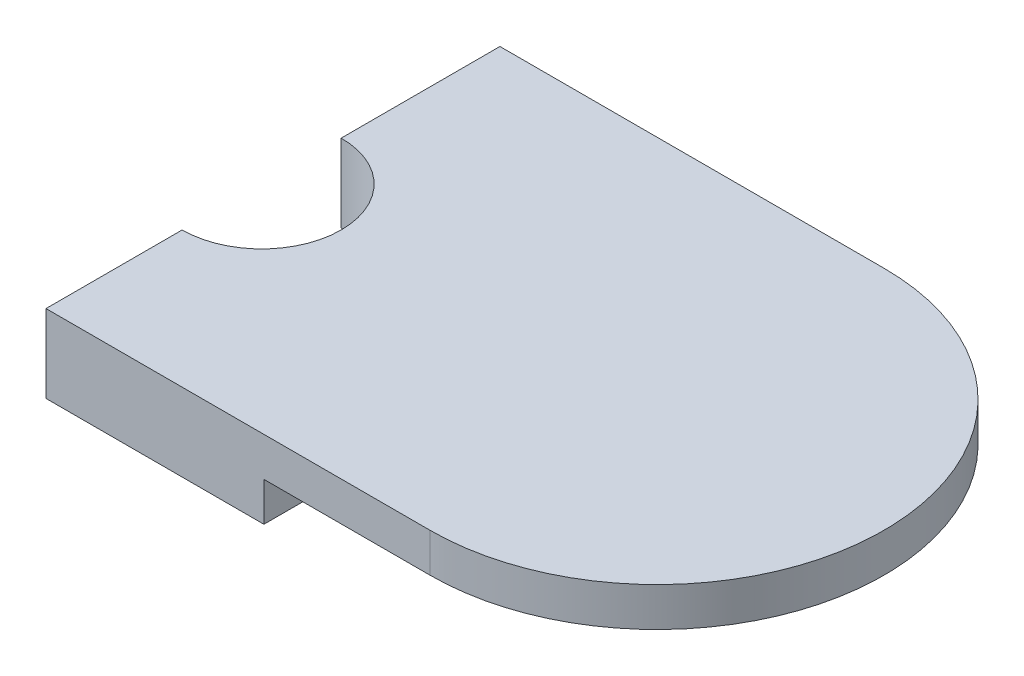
SolidWorks part; units mm, degrees
ref_plane "Front Plane" through (0, 0, 0) normal (0, 0, 1) x (1, 0, 0)
ref_plane "Top Plane" through (0, 0, 0) normal (0, 1, 0) x (1, 0, 0)
ref_plane "Right Plane" through (0, 0, 0) normal (1, 0, 0) x (0, 0, -1)
sketch "Sketch1"
extrude "Extrude1" add sketch "Sketch1" along normal mid plane 25.4
sketch "Sketch3"
extrude "Extrude2" cut sketch "Sketch3" against normal mid plane 12.7
sketch "Sketch5"
extrude "Extrude3" add sketch "Sketch5" along normal blind 30.892
